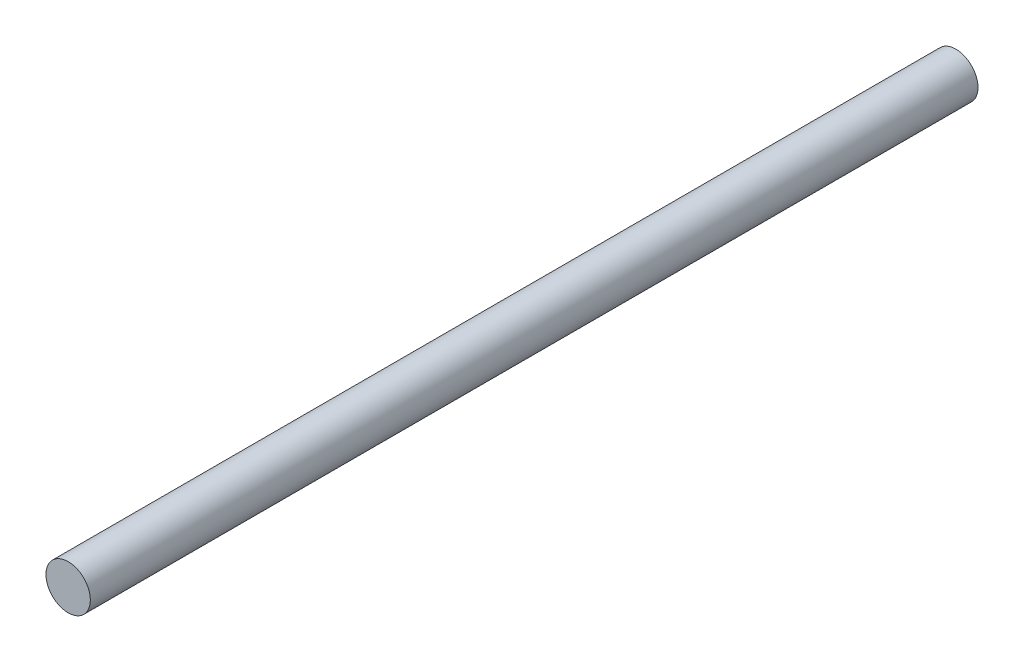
SolidWorks part; units mm, degrees
ref_plane "Plan de face" through (0, 0, 0) normal (0, 0, 1) x (1, 0, 0)
ref_plane "Plan de dessus" through (0, 0, 0) normal (0, 1, 0) x (1, 0, 0)
ref_plane "Plan de droite" through (0, 0, 0) normal (1, 0, 0) x (0, 0, -1)
sketch "Esquisse1" plane through (0, 0, 0) normal (0, 0, 1) x (1, 0, 0)
  circle A0 centre (0, 0) radius 2.5
  point P2 (0, 0)
  dimension "D1" = 5
extrude "Boss.-Extru.1" add sketch "Esquisse1" along normal mid plane 100
